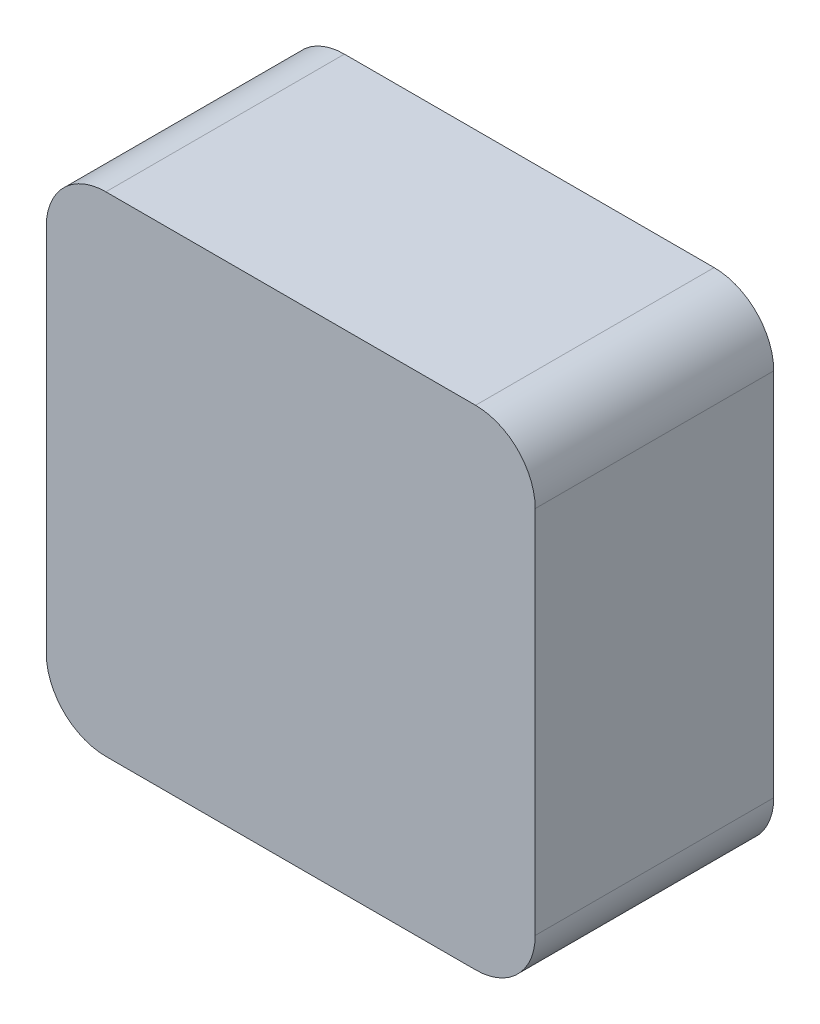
SolidWorks part; units mm, degrees
ref_plane "Front Plane" through (0, 0, 0) normal (0, 0, 1) x (1, 0, 0)
ref_plane "Top Plane" through (0, 0, 0) normal (0, 1, 0) x (1, 0, 0)
ref_plane "Right Plane" through (0, 0, 0) normal (1, 0, 0) x (0, 0, -1)
sketch "GENERAL" plane through (0, 0, 0) normal (0, 0, 1) x (1, 0, 0)
  line L4 (3.1, 4.1) -> (-3.1, 4.1)
  line L5 (-4.1, 3.1) -> (-4.1, -3.1)
  line L6 (-3.1, -4.1) -> (3.1, -4.1)
  line L7 (4.1, -3.1) -> (4.1, 3.1)
  arc A4 (4.1, 3.1) -> (3.1, 4.1) centre (3.1, 3.1) ccw
  arc A5 (-3.1, 4.1) -> (-4.1, 3.1) centre (-3.1, 3.1) ccw
  arc A6 (-4.1, -3.1) -> (-3.1, -4.1) centre (-3.1, -3.1) ccw
  arc A7 (3.1, -4.1) -> (4.1, -3.1) centre (3.1, -3.1) ccw
extrude "Boss-Extrude1" add sketch "GENERAL" along normal blind 4
